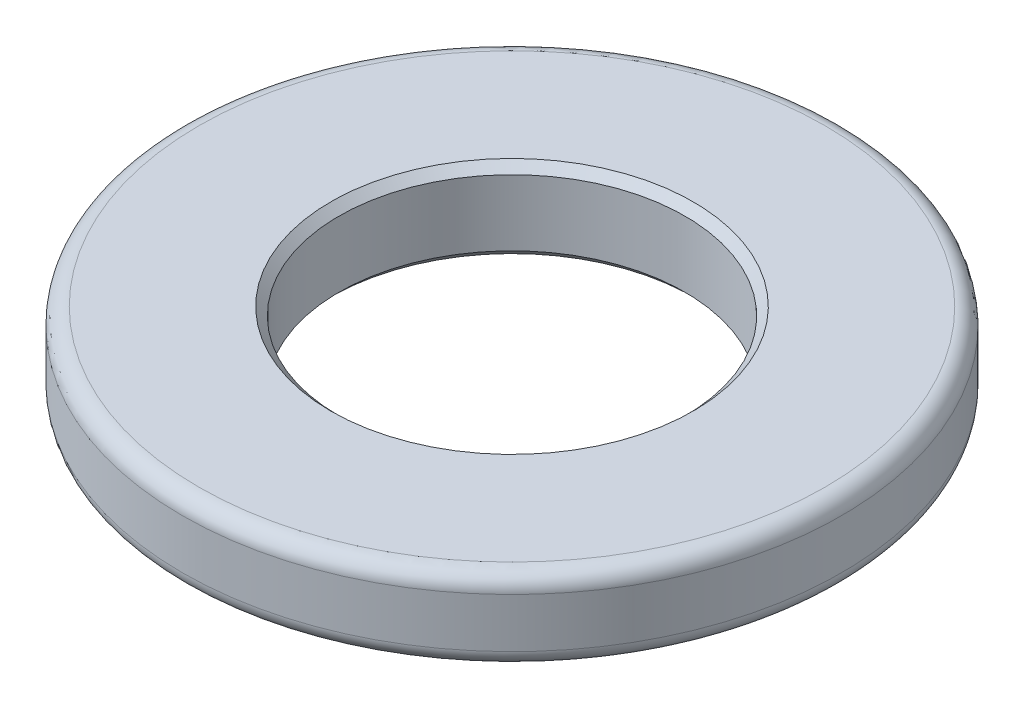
SolidWorks part; units mm, degrees
ref_plane "Front Plane" through (0, 0, 0) normal (0, 0, 1) x (1, 0, 0)
ref_plane "Top Plane" through (0, 0, 0) normal (0, 1, 0) x (1, 0, 0)
ref_plane "Right Plane" through (0, 0, 0) normal (1, 0, 0) x (0, 0, -1)
sketch "Sketch1" plane through (0, 0, 0) normal (0, 1, 0) x (1, 0, 0)
  circle A0 centre (0, 0) radius 2.1
  circle A1 centre (0, 0) radius 4
  dimension "D1" = 4.2
  dimension "D2" = 8
extrude "Boss-Extrude1" add sketch "Sketch1" along normal blind 1
fillet "Fillet1" radius 0.2 2 edges at (0, 0, 4) (0, 1, 4)
chamfer "Chamfer1" distance 0.1 angle 45 2 edges at (0, 0, 2.1) (0, 1, 2.1)
